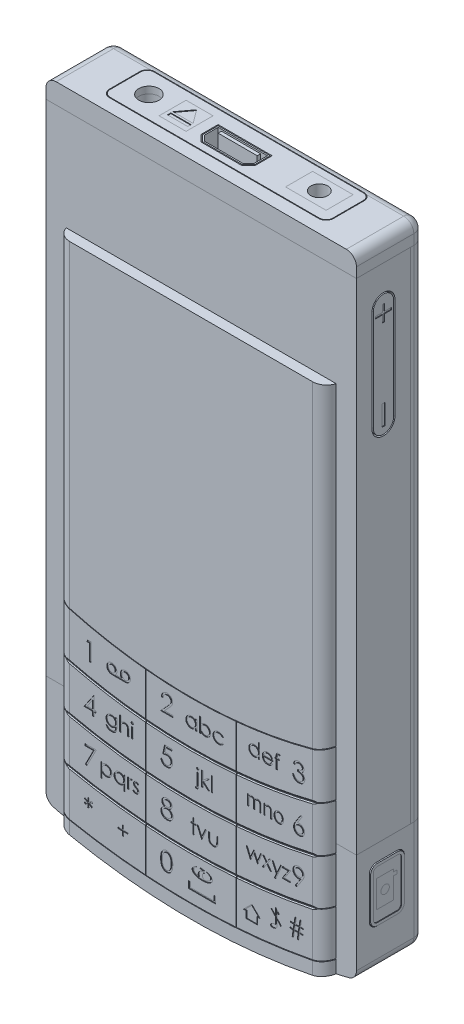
SolidWorks part; units mm, degrees
ref_plane "Front Plane" through (0, 0, 0) normal (0, 0, 1) x (1, 0, 0)
ref_plane "Top Plane" through (0, 0, 0) normal (0, 1, 0) x (1, 0, 0)
ref_plane "Right Plane" through (0, 0, 0) normal (1, 0, 0) x (0, 0, -1)
sketch "Sketch1" plane through (0, 0, 0) normal (0, 0, 1) x (1, 0, 0)
  line L0 (0, -93) -> (46, -93) construction
  line L1 (0, 0) -> (46, 0)
  line L2 (0, 0) -> (0, -93)
  line L3 (23, -96) -> (23, -93) construction
  line L4 (46, 0) -> (46, -93)
  arc A0 (0, -93) -> (46, -93) centre (23, -6.3333) ccw
  point P1 (46, -96)
  point P2 (0, -96)
  dimension "D1" = 46
  dimension "D2" = 93
  dimension "D3" = 3
extrude "Extrude1" add sketch "Sketch1" along normal blind 10
sketch "Sketch2" plane through (0, 0, 10) normal (0, 0, 1) x (1, 0, 0)
  line L0 (0, -3) -> (46, -3)
  line L1 (0, 0) -> (0, -93) construction
  line L2 (46, -93) -> (46, 0) construction
  line L3 (0, -77) -> (46, -77)
  line L4 (46, 0) -> (0, 0) construction
  arc A0 (0, -93) -> (46, -93) centre (23, -6.3333) ccw construction
  point P14 (23, -96)
  dimension "D1" = 19
  dimension "D2" = 3
split "Split1" trim tools "Sketch2" bodies to split 101 resulting bodies 102 103 104
sketch "Sketch3" plane through (0, 0, 10) normal (0, 0, 1) x (1, 0, 0)
  line L11 (0, -3) -> (0, -77) construction
  line L12 (46, -93) -> (46, -77) construction
  line L13 (3, -18) -> (3, -64.5)
  line L14 (23, -67.5) -> (23, -64.5) construction
  line L16 (3, -18) -> (43, -18)
  line L17 (0, -3) -> (46, -3) construction
  line L21 (43, -64.5) -> (43, -18)
  arc A1 (0, -93) -> (46, -93) centre (23, -6.3333) ccw construction
  arc A5 (3, -64.5) -> (43, -64.5) centre (23, 0.6667) ccw
  dimension "D4" = 3
  dimension "D1" = 3
  dimension "D3" = 15
  dimension "D2" = 3
  dimension "D5" = 46.5
extrude "Extrude2" add sketch "Sketch3" along normal blind 1.5
sketch "Sketch8" plane through (0, 0, 10) normal (0, 0, 1) x (1, 0, 0)
  line L0 (3, -64.6046) -> (3, -71.3754)
  line L1 (43, -64.6046) -> (43, -71.3754)
  line L2 (16.25, -67.2655) -> (16.25, -73.7947)
  line L3 (29.75, -67.2655) -> (29.75, -73.7947)
  line L4 (16.35, -67.2753) -> (16.35, -73.8037)
  line L5 (29.65, -67.2753) -> (29.65, -73.8037)
  line L6 (3, -85.0989) -> (3, -91.7609)
  line L7 (3, -64.5) -> (3, -93.7411) construction
  line L8 (3, -78.3069) -> (3, -84.9962)
  line L9 (3, -71.4791) -> (3, -78.2037)
  line L10 (43, -64.5) -> (43, -18) construction
  line L11 (43, -64.5) -> (43, -93.7411) construction
  line L12 (43, -71.4791) -> (43, -78.2037)
  line L13 (43, -78.3069) -> (43, -84.9962)
  line L14 (43, -85.0989) -> (43, -91.7609)
  line L15 (16.25, -87.1409) -> (16.25, -93.6588)
  line L16 (16.25, -64.5) -> (16.25, -93.7411) construction
  line L17 (16.35, -64.5) -> (16.35, -93.7411) construction
  line L18 (29.75, -64.5) -> (29.75, -93.7411) construction
  line L19 (29.65, -64.5) -> (29.65, -93.7411) construction
  line L20 (16.35, -87.1486) -> (16.35, -93.6659)
  line L21 (29.65, -87.1486) -> (29.65, -93.6659)
  line L22 (29.75, -87.1409) -> (29.75, -93.6588)
  line L23 (29.65, -80.5281) -> (29.65, -87.0483)
  line L24 (29.75, -80.5199) -> (29.75, -87.0406)
  line L25 (16.25, -80.5199) -> (16.25, -87.0406)
  line L26 (16.35, -80.5281) -> (16.35, -87.0483)
  line L27 (16.25, -73.8951) -> (16.25, -80.4195)
  line L28 (16.35, -73.9041) -> (16.35, -80.4278)
  line L29 (29.75, -73.8951) -> (29.75, -80.4195)
  line L30 (29.65, -73.9041) -> (29.65, -80.4278)
  arc A0 (3, -78.3069) -> (16.25, -80.5199) centre (23, 0.6667) ccw
  arc A1 (3, -71.3754) -> (16.25, -73.7947) centre (23, 0.6667) ccw
  arc A2 (2.9707, -64.5956) -> (43.0293, -64.5956) centre (23, 0.6667) ccw
  arc A3 (3, -64.6046) -> (16.25, -67.2655) centre (23, 0.6667) ccw
  arc A4 (0, -93) -> (46, -93) centre (23, -6.3333) ccw construction
  arc A5 (3, -71.4791) -> (16.25, -73.8951) centre (23, 0.6667) ccw
  arc A6 (3, -78.2037) -> (16.25, -80.4195) centre (23, 0.6667) ccw
  arc A7 (3, -84.9962) -> (16.25, -87.0406) centre (23, 0.6667) ccw
  arc A8 (3, -85.0989) -> (16.25, -87.1409) centre (23, 0.6667) ccw
  arc A9 (3, -91.7609) -> (16.25, -93.6588) centre (23, 0.6667) ccw
  arc A10 (16.35, -93.6659) -> (29.65, -93.6659) centre (23, 0.6667) ccw
  arc A11 (2.9707, -64.5956) -> (43.0293, -64.5956) centre (23, 0.6667) ccw construction
  arc A12 (1.0636, -70.8095) -> (44.9364, -70.8095) centre (23, 0.6667) ccw construction
  arc A13 (1.0342, -70.9051) -> (44.9658, -70.9051) centre (23, 0.6667) ccw construction
  arc A14 (-0.8729, -77.1191) -> (46.8729, -77.1191) centre (23, 0.6667) ccw construction
  arc A15 (-0.9022, -77.2147) -> (46.9022, -77.2147) centre (23, 0.6667) ccw construction
  arc A16 (-2.8093, -83.4286) -> (48.8093, -83.4286) centre (23, 0.6667) ccw construction
  arc A17 (-2.8386, -83.5242) -> (48.8386, -83.5242) centre (23, 0.6667) ccw construction
  arc A18 (-4.7457, -89.7381) -> (50.7457, -89.7381) centre (23, 0.6667) ccw construction
  arc A19 (29.75, -93.6588) -> (43, -91.7609) centre (23, 0.6667) ccw
  arc A20 (16.35, -87.0483) -> (29.65, -87.0483) centre (23, 0.6667) ccw
  arc A21 (16.35, -87.1486) -> (29.65, -87.1486) centre (23, 0.6667) ccw
  arc A22 (29.75, -87.0406) -> (43, -84.9962) centre (23, 0.6667) ccw
  arc A23 (29.75, -87.1409) -> (43, -85.0989) centre (23, 0.6667) ccw
  arc A24 (29.75, -80.4195) -> (43, -78.2037) centre (23, 0.6667) ccw
  arc A25 (29.75, -80.5199) -> (43, -78.3069) centre (23, 0.6667) ccw
  arc A26 (16.35, -80.4278) -> (29.65, -80.4278) centre (23, 0.6667) ccw
  arc A27 (16.35, -80.5281) -> (29.65, -80.5281) centre (23, 0.6667) ccw
  arc A28 (16.35, -73.8037) -> (29.65, -73.8037) centre (23, 0.6667) ccw
  arc A29 (16.35, -73.9041) -> (29.65, -73.9041) centre (23, 0.6667) ccw
  arc A30 (29.75, -73.7947) -> (43, -71.3754) centre (23, 0.6667) ccw
  arc A31 (29.75, -73.8951) -> (43, -71.4791) centre (23, 0.6667) ccw
  arc A32 (29.75, -67.2655) -> (43, -64.6046) centre (23, 0.6667) ccw
  arc A33 (16.35, -67.2753) -> (29.65, -67.2753) centre (23, 0.6667) ccw
  dimension "D9" = 13.25
  dimension "D1" = 0.1
  dimension "D2" = 6.5
  dimension "D3" = 0.1
  dimension "D4" = 6.5
  dimension "D5" = 0.1
  dimension "D6" = 6.5
  dimension "D7" = 0.1
  dimension "D8" = 6.5
  dimension "D10" = 13.25
  dimension "D11" = 0.1
  dimension "D12" = 0.1
extrude "Extrude3" add sketch "Sketch8" along normal blind 1.5 separate body
sketch "Sketch9" plane through (0, 0, 10) normal (0, 0, 1) x (1, 0, 0)
  line L0 (3, -91.8632) -> (3, -93.7411)
  line L1 (43, -91.8632) -> (43, -93.7411)
  line L2 (43, -91.7609) -> (43, -85.0989) construction
  line L3 (3, -85.0989) -> (3, -91.7609) construction
  arc A0 (0, -93) -> (46, -93) centre (23, -6.3333) ccw construction
  arc A1 (3, -93.7411) -> (43, -93.7411) centre (23, -6.3333) ccw
  arc A4 (2.9789, -91.8586) -> (16.2429, -93.7585) centre (23, 0.6667) ccw
  arc A5 (3, -91.8632) -> (43, -91.8632) centre (23, 0.6667) ccw
  dimension "D1" = 0.1
extrude "Extrude4" add sketch "Sketch9" along normal blind 1.5
sketch "Sketch11" plane through (0, -18, 0) normal (0, 1, 0) x (1, 0, 0)
  line L0 (3, -10) -> (3, -11.5)
  line L1 (3, -11.5) -> (3, -10) construction
  line L2 (3, -11.5) -> (5, -11.5)
  line L3 (43, -11.5) -> (3, -11.5) construction
  line L4 (41, -11.5) -> (43, -11.5)
  line L5 (43, -11.5) -> (43, -10)
  line L6 (43, -11.5) -> (43, -10) construction
  arc A0 (3, -10) -> (5, -11.5) centre (5.0125, -9.4) ccw
  arc A1 (41, -11.5) -> (43, -10) centre (40.9875, -9.4) ccw
  dimension "D3" = 2.1
  dimension "D6" = 2.1
  dimension "D1" = 1.5
  dimension "D2" = 2
  dimension "D4" = 2
  dimension "D5" = 1.5
extrude "Extrude5" cut sketch "Sketch11" against normal up to surface (75.7411 mm away)
chamfer "Chamfer1" distance 0.1 angle 60 1 edges at (10.5888, -73.0627, 11.5)
chamfer "Chamfer2" distance 0.1 angle 60
chamfer "Chamfer3" distance 0.1 angle 60
chamfer "Chamfer4" distance 0.1 angle 60
chamfer "Chamfer5" distance 0.1 angle 60
chamfer "Chamfer6" distance 0.1 angle 60
chamfer "Chamfer7" distance 0.1 angle 60
chamfer "Chamfer8" distance 0.1 angle 60
chamfer "Chamfer9" distance 0.1 angle 60
chamfer "Chamfer10" distance 0.1 angle 60
chamfer "Chamfer11" distance 0.1 angle 60
chamfer "Chamfer12" distance 0.1 angle 60
sketch "Sketch12" plane through (0, 0, 11.5) normal (0, 0, 1) x (1, 0, 0)
  line L0 (16.25, -70.4431) -> (5, -70.4431) construction
  line L1 (11.25, -70.4431) -> (13.25, -70.4431)
  line L2 (29.75, -87.1409) -> (29.75, -93.6588) construction
  line L3 (12.691, -70.1931) -> (11.809, -70.1931)
  line L4 (26.65, -92.2026) -> (26.65, -91.2026)
  line L5 (16.25, -73.6208) -> (16.25, -67.2655) construction
  line L6 (5, -71.7225) -> (5, -65.1842) construction
  line L7 (29.75, -70.4431) -> (41, -70.4431) construction
  line L8 (29.75, -67.2655) -> (29.75, -73.6208) construction
  line L9 (41, -71.7225) -> (41, -65.1842) construction
  line L10 (29.65, -71.4526) -> (16.35, -71.4526) construction
  line L11 (29.65, -73.6298) -> (29.65, -67.2753) construction
  line L12 (16.35, -67.2753) -> (16.35, -73.6298) construction
  line L13 (16.25, -77.1931) -> (5, -77.1931) construction
  line L14 (29.65, -78.2026) -> (16.35, -78.2026) construction
  line L15 (29.75, -77.1931) -> (41, -77.1931) construction
  line L16 (16.25, -83.9431) -> (5, -83.9431) construction
  line L17 (29.65, -84.9526) -> (16.35, -84.9526) construction
  line L18 (29.75, -83.9431) -> (41, -83.9431) construction
  line L19 (29.75, -90.6931) -> (41, -90.6931) construction
  line L20 (29.65, -91.7026) -> (16.35, -91.7026) construction
  line L21 (16.25, -90.6931) -> (5, -90.6931) construction
  line L22 (16.25, -69.6931) -> (5, -69.6931) construction
  line L23 (12.25, -69.6931) -> (12.25, -70.4431) construction
  line L24 (11.25, -69.6931) -> (11.25, -70.4431) construction
  line L25 (13.25, -69.6931) -> (13.25, -70.4431) construction
  line L26 (26.65, -91.2026) -> (26.4, -91.2026)
  line L27 (26.4, -91.2026) -> (26.4, -91.9526)
  line L28 (26.4, -91.9526) -> (22.9, -91.9526)
  line L29 (22.9, -91.9526) -> (22.9, -91.2026)
  line L30 (22.9, -91.2026) -> (22.65, -91.2026)
  line L31 (22.65, -91.2026) -> (22.65, -92.2026)
  line L32 (22.65, -92.2026) -> (26.65, -92.2026)
  line L33 (31.25, -91.6931) -> (31.25, -90.6931)
  line L34 (29.65, -93.6659) -> (29.65, -87.3223) construction
  line L35 (31.25, -90.6931) -> (31, -90.6931)
  line L36 (31, -90.6931) -> (32, -89.6931)
  line L37 (32, -89.6931) -> (33, -90.6931)
  line L38 (33, -90.6931) -> (32.75, -90.6931)
  line L39 (32.75, -90.6931) -> (32.75, -91.6931)
  line L40 (32.75, -91.6931) -> (31.25, -91.6931)
  line L41 (32, -89.5517) -> (33.2414, -90.7931)
  line L42 (33.2414, -90.7931) -> (32.85, -90.7931)
  line L43 (32.85, -90.7931) -> (32.85, -91.7931)
  line L44 (32.85, -91.7931) -> (31.15, -91.7931)
  line L45 (31.15, -91.7931) -> (31.15, -90.7931)
  line L46 (31.15, -90.7931) -> (30.7586, -90.7931)
  line L47 (30.7586, -90.7931) -> (32, -89.5517)
  line L48 (35.7192, -90.5452) -> (35.7192, -89.6275)
  line L49 (35.7192, -88.6836) -> (35.9433, -88.9263)
  line L50 (35.9433, -88.9263) -> (36.0902, -88.7907)
  line L51 (36.0902, -88.7907) -> (35.5192, -88.1721)
  line L52 (35.5192, -88.1721) -> (35.5192, -89.2339)
  line L53 (34.9304, -88.5961) -> (35.5192, -89.2339)
  line L54 (36.3765, -90.1626) -> (36.2883, -90.244)
  line L55 (36.2883, -90.244) -> (35.7192, -89.6275)
  line L56 (34.8423, -88.6774) -> (34.9304, -88.5961)
  line L57 (29.75, -87.3147) -> (29.75, -93.6588) construction
  line L58 (35.7192, -89.4505) -> (36.3765, -90.1626)
  line L59 (35.5192, -89.4108) -> (34.8423, -88.6774)
  line L60 (35.5192, -89.4108) -> (35.5192, -90.4036)
  line L61 (35.7192, -89.4505) -> (35.7192, -88.6836)
  arc A0 (11.809, -70.1931) -> (11.25, -70.4431) centre (11.25, -69.6931) ccw
  arc A1 (13.25, -70.4431) -> (12.691, -70.1931) centre (13.25, -69.6931) ccw
  circle A2 centre (11.25, -69.6931) radius 0.5
  circle A3 centre (13.25, -69.6931) radius 0.5
  circle A5 centre (11.25, -69.6931) radius 0.75 construction
  circle A6 centre (13.25, -69.6931) radius 0.75 construction
  ellipse E0 centre (35.25, -90.6931) end of major axis (35.7192, -90.5452) minor radius 0.2729 (35.5192, -90.4036) -> (35.7192, -90.5452) ccw
  text T0 "  1" font "Century Gothic" height in points 10
  text T1 "  2" font "Century Gothic" height in points 10
  text T2 "       abc" font "Century Gothic" height in points 8
  text T3 "  3 " font "Century Gothic" height in points 10
  text T4 "  def" font "Century Gothic" height in points 8
  text T5 "  4" font "Century Gothic" height in points 10
  text T6 "ghi  " font "Century Gothic" height in points 8
  text T7 "  5" font "Century Gothic" height in points 10
  text T8 "jkl    " font "Century Gothic" height in points 8
  text T9 "6 " font "Century Gothic" height in points 10
  text T10 "  mno" font "Century Gothic" height in points 8
  text T11 "  7" font "Century Gothic" height in points 10
  text T12 "pqrs " font "Century Gothic" height in points 8
  text T13 " 8  " font "Century Gothic" height in points 10
  text T14 "tvu   " font "Century Gothic" height in points 8
  text T15 "  9 " font "Century Gothic" height in points 10
  text T16 "wxyz    " font "Century Gothic" height in points 8
  text T17 "  *" font "Century Gothic" height in points 10
  text T18 "+   " font "Century Gothic" height in points 8
  text T19 "  0" font "Century Gothic" height in points 10
  text T20 "# " font "Century Gothic" height in points 10
  point P18 (16.35, -70.4526)
  point P48 (16.25, -70.1931)
  point P49 (5, -70.1931)
  point P54 (12.4672, -69.4738)
  point P59 (14.4672, -69.4738)
  point P78 (29.65, -92.2026)
  point P79 (16.35, -92.2026)
  dimension "D1" = 1
  dimension "D12" = 4
  dimension "D13" = 0.25
  dimension "D16" = 0.25
  dimension "D17" = 0.25
  dimension "D18" = 1
  dimension "D19" = 1
  dimension "D20" = 4
  dimension "D21" = 0.5
  dimension "D15" = 0.25
  dimension "D22" = 3
  dimension "D23" = 1.5
  dimension "D24" = 0.25
  dimension "D25" = 0.25
  dimension "D26" = 0.75
  dimension "D27" = 1
  dimension "D28" = 1
  dimension "D29" = 1
  dimension "D30" = 1.5
  dimension "D32" = 0.12
  dimension "D33" = 0.2
  dimension "D34" = 0.2
  dimension "D35" = 5.5
  dimension "D2" = 6.75
  dimension "D3" = 6.75
  dimension "D4" = 6.75
  dimension "D5" = 6.75
  dimension "D6" = 6.75
  dimension "D7" = 6.75
  dimension "D8" = 6.75
  dimension "D9" = 0.75
  dimension "D10" = 1
  dimension "D11" = 1
  dimension "D14" = 0.25
  dimension "D31" = 0.1
extrude "Extrude6" cut sketch "Sketch12" against normal blind 0.1
sketch "Sketch14" plane through (0, 0, 11.5) normal (0, 0, 1) x (1, 0, 0)
  line L16 (24.05, -88.7823) -> (24.05, -88.7652)
  line L18 (25.25, -88.7823) -> (25.25, -88.7652)
  line L21 (24.05, -88.7652) -> (25.25, -88.7652) construction
  arc A1 (24.15, -89.9483) -> (24.05, -89.7026) centre (24.4273, -89.6923) cw
  arc A2 (24.05, -89.7026) -> (25.0478, -89.1026) centre (24.7183, -89.6843) cw
  arc A3 (25.0478, -89.1026) -> (25.05, -89.9684) centre (25.0844, -89.5354) ccw
  ellipse E0 centre (24.65, -89.4526) end of major axis (23.15, -89.4526) minor radius 0.75 (24.05, -88.7652) -> (25.25, -88.7652) ccw
  ellipse E1 centre (24.65, -89.3526) end of major axis (23.4, -89.3526) minor radius 0.65 (24.05, -88.7823) -> (24.15, -89.9483) ccw
  ellipse E2 centre (24.65, -88.7652) end of major axis (24.35, -88.7652) minor radius 0.1
  ellipse E3 centre (24.65, -89.3526) end of major axis (23.4, -89.3526) minor radius 0.65 (25.05, -89.9684) -> (25.25, -88.7823) ccw
  point P33 (25.25, -91.9526)
  point P35 (25.25, -87.5578)
  point P41 (24.05, -91.9526)
  point P42 (24.05, -87.5578)
  dimension "D12" = 0.1
  dimension "D13" = 0.3
extrude "Extrude7" cut sketch "Sketch14" against normal blind 0.1
sketch "Sketch15" plane through (0, 0, 0) normal (-1, 0, 0) x (0, 0, 1)
  line L0 (2, -3) -> (2, -77)
  line L1 (10, -3) -> (0, -3) construction
  line L2 (10, -77) -> (0, -77) construction
  line L3 (0, -3) -> (0, -77) construction
  dimension "D1" = 2
split "Split2" trim tools "Sketch15" bodies to split 137 resulting bodies 154 155
sketch "Sketch16" plane through (46, 0, 0) normal (1, 0, 0) x (0, 0, -1)
  line L0 (-6, -8.5) -> (-6, -23.5) construction
  line L1 (-4.5, -8.5) -> (-4.5, -23.5)
  line L2 (-7.5, -8.5) -> (-7.5, -23.5)
  line L3 (-2, -3) -> (-2, -77) construction
  line L5 (-2, -3) -> (-10, -3) construction
  arc A0 (-4.5, -8.5) -> (-7.5, -8.5) centre (-6, -8.5) ccw
  arc A1 (-7.5, -23.5) -> (-4.5, -23.5) centre (-6, -23.5) ccw
  point P2 (-6, -16)
  point P9 (-6, -3)
  dimension "D1" = 3
  dimension "D2" = 2.5
  dimension "D3" = 15
  dimension "D4" = 5.5
extrude "Extrude8" cut sketch "Sketch16" against normal blind 1
chamfer "Chamfer13" distance 0.2 angle 60 4 edges at (46, -16, 4.5) (46, -7, 6) (46, -25, 6) (46, -16, 7.5)
sketch "Sketch18" plane through (45, 0, 0) normal (1, 0, 0) x (0, 0, -1)
  line L2 (-7.5, -8.5) -> (-7.5, -23.5)
  line L3 (-4.5, -23.5) -> (-4.5, -8.5)
  line L4 (-7.5, -8.5) -> (-7.5, -23.5)
  line L5 (-4.5, -23.5) -> (-4.5, -8.5)
  arc A2 (-4.5, -8.5) -> (-7.5, -8.5) centre (-6, -8.5) ccw
  arc A3 (-7.5, -23.5) -> (-4.5, -23.5) centre (-6, -23.5) ccw
  arc A4 (-4.5, -8.5) -> (-7.5, -8.5) centre (-6, -8.5) ccw
  arc A5 (-7.5, -23.5) -> (-4.5, -23.5) centre (-6, -23.5) ccw
  dimension "D1" = 0
extrude "Extrude9" add sketch "Sketch18" along normal blind 1 separate body
sketch "Sketch19" plane through (46, 0, 0) normal (1, 0, 0) x (0, 0, -1)
  line L3 (-4.5, -23.5) -> (-4.5, -8.5) construction
  line L4 (-6.25, -21) -> (-5.75, -21)
  line L5 (-6.25, -21) -> (-6.25, -24)
  line L6 (-6.25, -24) -> (-5.75, -24)
  line L7 (-5.75, -21) -> (-5.75, -24)
  arc A3 (-7.5, -23.5) -> (-4.5, -23.5) centre (-6, -23.5) ccw construction
  text T0 "+"
  point P18 (-6, -25)
  dimension "D1" = 0.5
  dimension "D2" = 3
  dimension "D3" = 1
  dimension "D4" = 1.25
extrude "Extrude10" cut sketch "Sketch19" against normal blind 0.1
sketch "Sketch20" plane through (46, 0, 0) normal (1, 0, 0) x (0, 0, -1)
  line L0 (-2, -77) -> (-10, -77) construction
  line L1 (-7, -79.5) -> (-4, -79.5)
  line L2 (-8, -80.5) -> (-8, -86.5)
  line L3 (-7, -87.5) -> (-4, -87.5)
  line L4 (-3, -80.5) -> (-3, -86.5)
  line L5 (-10, -84.9962) -> (-10, -78.3069) construction
  arc A0 (-7, -79.5) -> (-8, -80.5) centre (-7, -80.5) ccw
  arc A1 (-4, -79.5) -> (-3, -80.5) centre (-4, -80.5) cw
  arc A2 (-4, -87.5) -> (-3, -86.5) centre (-4, -86.5) ccw
  arc A3 (-8, -86.5) -> (-7, -87.5) centre (-7, -86.5) ccw
  point P10 (-8, -79.5)
  point P15 (-3, -87.5)
  point P18 (-8, -87.5)
  dimension "D5" = 1
  dimension "D1" = 5
  dimension "D2" = 2.5
  dimension "D3" = 8
  dimension "D4" = 2
extrude "Extrude11" cut sketch "Sketch20" against normal blind 1
sketch "Sketch21" plane through (45, 0, 0) normal (1, 0, 0) x (0, 0, -1)
  line L0 (-4, -79.9) -> (-7, -79.9)
  line L1 (-7.6, -80.5) -> (-7.6, -86.5)
  line L2 (-7, -87.1) -> (-4, -87.1)
  line L3 (-3.4, -86.5) -> (-3.4, -80.5)
  line L4 (-8, -80.5) -> (-8, -86.5)
  line L5 (-7, -87.5) -> (-4, -87.5)
  line L6 (-3, -86.5) -> (-3, -80.5)
  line L7 (-4, -79.5) -> (-7, -79.5)
  line L8 (-8, -80.5) -> (-8, -86.5)
  line L9 (-7, -87.5) -> (-4, -87.5)
  line L10 (-3, -86.5) -> (-3, -80.5)
  line L11 (-4, -79.5) -> (-7, -79.5)
  arc A0 (-7, -79.9) -> (-7.6, -80.5) centre (-7, -80.5) ccw
  arc A1 (-7.6, -86.5) -> (-7, -87.1) centre (-7, -86.5) ccw
  arc A2 (-4, -87.1) -> (-3.4, -86.5) centre (-4, -86.5) ccw
  arc A3 (-3.4, -80.5) -> (-4, -79.9) centre (-4, -80.5) ccw
  arc A4 (-7, -79.5) -> (-8, -80.5) centre (-7, -80.5) ccw
  arc A5 (-8, -86.5) -> (-7, -87.5) centre (-7, -86.5) ccw
  arc A6 (-4, -87.5) -> (-3, -86.5) centre (-4, -86.5) ccw
  arc A7 (-3, -80.5) -> (-4, -79.5) centre (-4, -80.5) ccw
  arc A8 (-7, -79.5) -> (-8, -80.5) centre (-7, -80.5) ccw
  arc A9 (-8, -86.5) -> (-7, -87.5) centre (-7, -86.5) ccw
  arc A10 (-4, -87.5) -> (-3, -86.5) centre (-4, -86.5) ccw
  arc A11 (-3, -80.5) -> (-4, -79.5) centre (-4, -80.5) ccw
  dimension "D1" = 0
  dimension "D2" = 0.4
extrude "Extrude12" add sketch "Sketch21" along normal blind 1.1 separate body
chamfer "Chamfer14" distance 0.1 angle 60
sketch "Sketch22" plane through (45, 0, 0) normal (1, 0, 0) x (0, 0, -1)
  line L0 (-3.4, -86.5) -> (-3.4, -80.5) construction
  line L1 (-3.4, -86.5) -> (-3.4, -80.5)
  line L2 (-7, -87.1) -> (-4, -87.1) construction
  line L3 (-7.6, -80.5) -> (-7.6, -86.5) construction
  line L4 (-4, -79.9) -> (-7, -79.9) construction
  line L5 (-7, -87.1) -> (-4, -87.1)
  line L6 (-7.6, -80.5) -> (-7.6, -86.5)
  line L7 (-4, -79.9) -> (-7, -79.9)
  arc A0 (-4, -87.1) -> (-3.4, -86.5) centre (-4, -86.5) ccw construction
  arc A1 (-7.6, -86.5) -> (-7, -87.1) centre (-7, -86.5) ccw construction
  arc A2 (-7, -79.9) -> (-7.6, -80.5) centre (-7, -80.5) ccw construction
  arc A3 (-3.4, -80.5) -> (-4, -79.9) centre (-4, -80.5) ccw construction
  arc A4 (-4, -87.1) -> (-3.4, -86.5) centre (-4, -86.5) ccw
  arc A5 (-7.6, -86.5) -> (-7, -87.1) centre (-7, -86.5) ccw
  arc A6 (-7, -79.9) -> (-7.6, -80.5) centre (-7, -80.5) ccw
  arc A7 (-3.4, -80.5) -> (-4, -79.9) centre (-4, -80.5) ccw
extrude "Extrude13" add sketch "Sketch22" along normal blind 1 separate body
sketch "Sketch23" plane through (46, 0, 0) normal (1, 0, 0) x (0, 0, -1)
  line L0 (-7.6, -80.5) -> (-7.6, -86.5) construction
  line L1 (-7, -81.5) -> (-4.5, -81.5)
  line L2 (-7, -81.5) -> (-7, -85.5)
  line L3 (-7, -85.5) -> (-4.5, -85.5)
  line L4 (-4.5, -81.5) -> (-4.5, -81.9)
  line L6 (-4, -79.9) -> (-7, -79.9) construction
  line L7 (-7, -87.1) -> (-4, -87.1) construction
  line L8 (-4.5, -82.4) -> (-4.5, -85.5)
  line L9 (-4.5, -81.9) -> (-4, -81.9)
  line L11 (-4.5, -82.4) -> (-4, -82.4)
  line L12 (-4, -81.9) -> (-4, -82.4)
  circle A0 centre (-5.75, -83.5) radius 0.625
  dimension "D6" = 1.25
  dimension "D7" = 1.25
  dimension "D8" = 2
  dimension "D1" = 2.5
  dimension "D2" = 0.6
  dimension "D3" = 4
  dimension "D4" = 1.6
  dimension "D5" = 1.6
  dimension "D9" = 0.5
  dimension "D10" = 0.5
  dimension "D11" = 0.4
extrude "Extrude14" cut sketch "Sketch23" against normal blind 0.1
sketch "Sketch24" plane through (45.9, 0, 0) normal (1, 0, 0) x (0, 0, -1)
  line L8 (-7, -81.5) -> (-7, -85.5)
  line L9 (-7, -85.5) -> (-4.5, -85.5)
  line L10 (-4.5, -85.5) -> (-4.5, -82.4)
  line L11 (-4.5, -82.4) -> (-4, -82.4)
  line L12 (-4, -82.4) -> (-4, -81.9)
  line L13 (-4, -81.9) -> (-4.5, -81.9)
  line L14 (-4.5, -81.9) -> (-4.5, -81.5)
  line L15 (-4.5, -81.5) -> (-7, -81.5)
  line L16 (-7, -81.5) -> (-7, -85.5)
  line L17 (-7, -85.5) -> (-4.5, -85.5)
  line L18 (-4.5, -85.5) -> (-4.5, -82.4)
  line L19 (-4.5, -82.4) -> (-4, -82.4)
  line L20 (-4, -82.4) -> (-4, -81.9)
  line L21 (-4, -81.9) -> (-4.5, -81.9)
  line L22 (-4.5, -81.9) -> (-4.5, -81.5)
  line L23 (-4.5, -81.5) -> (-7, -81.5)
  circle A0 centre (-5.75, -83.5) radius 0.625 construction
  circle A1 centre (-5.75, -83.5) radius 0.625
  dimension "D1" = 0
extrude "Extrude15" add sketch "Sketch24" along normal blind 0.1 separate body
sketch "Sketch25" plane through (0, 0, 0) normal (0, 1, 0) x (1, 0, 0)
  line L0 (46, 0) -> (0, 0) construction
  line L1 (7.5, -1.5) -> (38.5, -1.5)
  line L2 (6.5, -2.5) -> (6.5, -7)
  line L3 (7.5, -8) -> (38.5, -8)
  line L4 (39.5, -2.5) -> (39.5, -7)
  line L6 (0, -10) -> (0, 0) construction
  arc A0 (7.5, -1.5) -> (6.5, -2.5) centre (7.5, -2.5) ccw
  arc A1 (6.5, -7) -> (7.5, -8) centre (7.5, -7) ccw
  arc A2 (38.5, -8) -> (39.5, -7) centre (38.5, -7) ccw
  arc A3 (38.5, -1.5) -> (39.5, -2.5) centre (38.5, -2.5) cw
  point P10 (6.5, -1.5)
  point P13 (6.5, -8)
  point P16 (39.5, -8)
  dimension "D5" = 1
  dimension "D1" = 6.5
  dimension "D2" = 1.5
  dimension "D3" = 33
  dimension "D4" = 6.5
extrude "Extrude16" cut sketch "Sketch25" against normal blind 1
chamfer "Chamfer15" distance 0.1 angle 60 8 edges at (39.5, 0, 4.75) (39.2071, 0, 1.7929) (39.2071, 0, 7.7071) (23, 0, 1.5) (23, 0, 8) (6.7929, 0, 1.7929) (6.7929, 0, 7.7071) (6.5, 0, 4.75)
sketch "Sketch26" plane through (0, -1, 0) normal (0, 1, 0) x (1, 0, 0)
  line L4 (6.5, -2.5) -> (6.5, -7)
  line L5 (7.5, -8) -> (38.5, -8)
  line L6 (39.5, -7) -> (39.5, -2.5)
  line L7 (38.5, -1.5) -> (7.5, -1.5)
  line L8 (6.5, -2.5) -> (6.5, -7)
  line L9 (7.5, -8) -> (38.5, -8)
  line L10 (39.5, -7) -> (39.5, -2.5)
  line L11 (38.5, -1.5) -> (7.5, -1.5)
  arc A4 (7.5, -1.5) -> (6.5, -2.5) centre (7.5, -2.5) ccw
  arc A5 (6.5, -7) -> (7.5, -8) centre (7.5, -7) ccw
  arc A6 (38.5, -8) -> (39.5, -7) centre (38.5, -7) ccw
  arc A7 (39.5, -2.5) -> (38.5, -1.5) centre (38.5, -2.5) ccw
  arc A8 (7.5, -1.5) -> (6.5, -2.5) centre (7.5, -2.5) ccw
  arc A9 (6.5, -7) -> (7.5, -8) centre (7.5, -7) ccw
  arc A10 (38.5, -8) -> (39.5, -7) centre (38.5, -7) ccw
  arc A11 (39.5, -2.5) -> (38.5, -1.5) centre (38.5, -2.5) ccw
  dimension "D1" = 0
extrude "Extrude17" add sketch "Sketch26" along normal blind 1 separate body
sketch "Sketch27" plane through (0, 0, 0) normal (0, 1, 0) x (1, 0, 0)
  line L0 (6.4, -4.75) -> (39.6, -4.75) construction
  line L1 (6.4, -7) -> (6.4, -2.5) construction
  line L2 (39.6, -2.5) -> (39.6, -7) construction
  line L3 (6.5, -2.5) -> (6.5, -7) construction
  line L4 (38.5, -1.5) -> (7.5, -1.5) construction
  line L5 (32, -2.5) -> (38, -2.5)
  line L6 (32, -2.5) -> (32, -6.5)
  line L7 (32, -6.5) -> (38, -6.5)
  line L8 (38, -2.5) -> (38, -6.5)
  line L9 (39.5, -7) -> (39.5, -2.5) construction
  line L10 (7.5, -8) -> (38.5, -8) construction
  line L11 (19, -3.5) -> (27, -3.5)
  line L12 (19, -3.5) -> (19, -6)
  line L13 (20, -7) -> (26, -7)
  line L14 (27, -3.5) -> (27, -6)
  line L15 (19, -6) -> (20, -7)
  line L16 (26, -7) -> (27, -6)
  line L18 (13.5, -2.75) -> (17.5, -2.75)
  line L19 (13.5, -2.75) -> (13.5, -6.75)
  line L20 (13.5, -6.75) -> (17.5, -6.75)
  line L21 (17.5, -2.75) -> (17.5, -6.75)
  circle A0 centre (10, -4.75) radius 1.5
  point P19 (27, -7)
  point P20 (19, -7)
  dimension "D1" = 3
  dimension "D2" = 3.5
  dimension "D3" = 4
  dimension "D4" = 1
  dimension "D5" = 6
  dimension "D6" = 1.5
  dimension "D7" = 8
  dimension "D8" = 12.5
  dimension "D9" = 3.5
  dimension "D10" = 1
  dimension "D13" = 1
  dimension "D14" = 1
  dimension "D11" = 4
  dimension "D12" = 4
  dimension "D15" = 2
  dimension "D16" = 7
extrude "Extrude18" cut sketch "Sketch27" against normal blind 5
sketch "Sketch28" plane through (0, -5, 0) normal (0, 1, 0) x (1, 0, 0)
  line L4 (13.5, -2.75) -> (13.5, -6.75)
  line L5 (13.5, -6.75) -> (17.5, -6.75)
  line L6 (17.5, -6.75) -> (17.5, -2.75)
  line L7 (17.5, -2.75) -> (13.5, -2.75)
  line L8 (13.5, -2.75) -> (13.5, -6.75)
  line L9 (13.5, -6.75) -> (17.5, -6.75)
  line L10 (17.5, -6.75) -> (17.5, -2.75)
  line L11 (17.5, -2.75) -> (13.5, -2.75)
  line L12 (32, -2.5) -> (32, -6.5)
  line L13 (32, -6.5) -> (38, -6.5)
  line L14 (38, -6.5) -> (38, -2.5)
  line L15 (38, -2.5) -> (32, -2.5)
  line L16 (32, -2.5) -> (32, -6.5)
  line L17 (32, -6.5) -> (38, -6.5)
  line L18 (38, -6.5) -> (38, -2.5)
  line L19 (38, -2.5) -> (32, -2.5)
  circle A0 centre (35, -4.5) radius 1.25
  dimension "D3" = 2.5
  dimension "D4" = 2
  dimension "D5" = 3
  dimension "D1" = 0
  dimension "D2" = 0
extrude "Extrude19" add sketch "Sketch28" along normal blind 5 separate body
sketch "Sketch29" plane through (0, -5, 0) normal (0, 1, 0) x (1, 0, 0)
  line L6 (26.65, -3.85) -> (19.35, -3.85)
  line L7 (19.35, -3.85) -> (19.35, -5.855)
  line L8 (19.35, -5.855) -> (20.145, -6.65)
  line L9 (20.145, -6.65) -> (25.855, -6.65)
  line L10 (25.855, -6.65) -> (26.65, -5.855)
  line L11 (26.65, -5.855) -> (26.65, -3.85)
  line L12 (19.15, -3.65) -> (19.15, -5.9379)
  line L13 (19.15, -5.9379) -> (20.0621, -6.85)
  line L14 (20.0621, -6.85) -> (25.9379, -6.85)
  line L15 (25.9379, -6.85) -> (26.85, -5.9379)
  line L16 (26.85, -5.9379) -> (26.85, -3.65)
  line L17 (26.85, -3.65) -> (19.15, -3.65)
  line L18 (19.15, -3.65) -> (19.15, -5.9379)
  line L19 (19.15, -5.9379) -> (20.0621, -6.85)
  line L20 (20.0621, -6.85) -> (25.9379, -6.85)
  line L21 (25.9379, -6.85) -> (26.85, -5.9379)
  line L22 (26.85, -5.9379) -> (26.85, -3.65)
  line L23 (26.85, -3.65) -> (19.15, -3.65)
  line L25 (20.1, -4.1) -> (25.9, -4.1)
  line L26 (20.1, -4.1) -> (20.1, -4.6)
  line L27 (20.1, -4.6) -> (25.9, -4.6)
  line L28 (25.9, -4.1) -> (25.9, -4.6)
  dimension "D3" = 0.5
  dimension "D4" = 0.25
  dimension "D5" = 0.75
  dimension "D6" = 0.75
  dimension "D1" = 0.15
  dimension "D2" = 0.2
extrude "Extrude20" add sketch "Sketch29" along normal blind 5 separate body contours L28 L25 L26 L27 | L22 L23 L18 L19 L20 L21 L11 L10 L9 L8 L7 L6
sketch "Sketch30" plane through (0, 0, 0) normal (0, 1, 0) x (1, 0, 0)
  line L0 (15.5, -2.75) -> (15.5, -6.75) construction
  line L1 (17.5, -2.75) -> (13.5, -2.75) construction
  line L2 (13.5, -6.75) -> (17.5, -6.75) construction
  line L3 (13.5, -2.75) -> (13.5, -6.75) construction
  line L4 (14, -5.5) -> (17, -5.5)
  line L5 (14, -5.5) -> (14, -6)
  line L6 (14, -6) -> (17, -6)
  line L7 (17, -5.5) -> (17, -6)
  line L8 (17.5, -6.75) -> (17.5, -2.75) construction
  line L9 (13.5, -6.75) -> (17.5, -6.75) construction
  line L10 (17, -5.2) -> (14, -5.2)
  line L11 (14, -5.2) -> (15.5, -3.2)
  line L12 (15.5, -3.2) -> (17, -5.2)
  dimension "D1" = 0.5
  dimension "D2" = 0.5
  dimension "D3" = 0.5
  dimension "D4" = 0.75
  dimension "D5" = 2
  dimension "D6" = 0.3
extrude "Extrude21" cut sketch "Sketch30" against normal blind 0.1
sketch "Sketch31" plane through (0, 0, 0) normal (0, 0, -1) x (-1, 0, 0)
  line L0 (-46, -77) -> (-46, -3) construction
  line L1 (-38.5, -13) -> (-30.5, -13)
  line L2 (-41, -15.5) -> (-41, -23.5)
  line L3 (-38.5, -26) -> (-30.5, -26)
  line L4 (-28, -15.5) -> (-28, -23.5)
  line L5 (0, -3) -> (-46, -3) construction
  line L6 (-38.5, -15) -> (-30.5, -15)
  line L7 (-30, -15.5) -> (-30, -23.5)
  line L8 (-38.5, -24) -> (-30.5, -24)
  line L9 (-39, -15.5) -> (-39, -23.5)
  arc A0 (-38.5, -13) -> (-41, -15.5) centre (-38.5, -15.5) ccw
  arc A1 (-41, -23.5) -> (-38.5, -26) centre (-38.5, -23.5) ccw
  arc A2 (-30.5, -26) -> (-28, -23.5) centre (-30.5, -23.5) ccw
  arc A3 (-30.5, -13) -> (-28, -15.5) centre (-30.5, -15.5) cw
  arc A4 (-30.5, -15) -> (-30, -15.5) centre (-30.5, -15.5) cw
  arc A5 (-30.5, -24) -> (-30, -23.5) centre (-30.5, -23.5) ccw
  arc A6 (-39, -23.5) -> (-38.5, -24) centre (-38.5, -23.5) ccw
  arc A7 (-38.5, -15) -> (-39, -15.5) centre (-38.5, -15.5) ccw
  circle A8 centre (-34.5, -19.5) radius 2.5
  point P10 (-41, -13)
  point P13 (-41, -26)
  point P18 (-28, -13)
  dimension "D5" = 2.5
  dimension "D7" = 5
  dimension "D8" = 4.5
  dimension "D9" = 4.5
  dimension "D1" = 5
  dimension "D2" = 13
  dimension "D3" = 10
  dimension "D4" = 13
  dimension "D6" = 2
extrude "Extrude22" cut sketch "Sketch31" against normal blind 5 contours A8 | A3 L1 A0 L2 A1 L3 A2 L4 A7 L6 A4 L7 A5 L8 A6 L9
sketch "Sketch32" plane through (0, 0, 5) normal (0, 0, -1) x (-1, 0, 0)
  line L1 (-30.5, -15) -> (-38.5, -15)
  line L2 (-39, -15.5) -> (-39, -23.5)
  line L3 (-38.5, -24) -> (-30.5, -24)
  line L4 (-30.5, -13) -> (-38.5, -13)
  line L5 (-41, -15.5) -> (-41, -23.5)
  line L6 (-38.5, -26) -> (-30.5, -26)
  line L7 (-28, -23.5) -> (-28, -15.5)
  line L8 (-30.5, -13) -> (-38.5, -13)
  line L9 (-41, -15.5) -> (-41, -23.5)
  line L10 (-38.5, -26) -> (-30.5, -26)
  line L11 (-28, -23.5) -> (-28, -15.5)
  line L12 (-30, -23.5) -> (-30, -15.5)
  arc A0 (-38.5, -15) -> (-39, -15.5) centre (-38.5, -15.5) ccw
  arc A1 (-39, -23.5) -> (-38.5, -24) centre (-38.5, -23.5) ccw
  arc A2 (-30.5, -24) -> (-30, -23.5) centre (-30.5, -23.5) ccw
  arc A3 (-30, -15.5) -> (-30.5, -15) centre (-30.5, -15.5) ccw
  arc A4 (-28, -15.5) -> (-30.5, -13) centre (-30.5, -15.5) ccw
  arc A5 (-38.5, -13) -> (-41, -15.5) centre (-38.5, -15.5) ccw
  arc A6 (-41, -23.5) -> (-38.5, -26) centre (-38.5, -23.5) ccw
  arc A7 (-30.5, -26) -> (-28, -23.5) centre (-30.5, -23.5) ccw
  arc A8 (-28, -15.5) -> (-30.5, -13) centre (-30.5, -15.5) ccw
  arc A9 (-38.5, -13) -> (-41, -15.5) centre (-38.5, -15.5) ccw
  arc A10 (-41, -23.5) -> (-38.5, -26) centre (-38.5, -23.5) ccw
  arc A11 (-30.5, -26) -> (-28, -23.5) centre (-30.5, -23.5) ccw
  dimension "D1" = 0
  dimension "D2" = 2
extrude "Extrude23" add sketch "Sketch32" along normal blind 5.25 separate body
sketch "Sketch33" plane through (0, 0, 5) normal (0, 0, -1) x (-1, 0, 0)
  circle A0 centre (-34.5, -19.5) radius 1.25
  circle A1 centre (-34.5, -19.5) radius 2.5
  circle A2 centre (-34.5, -19.5) radius 2.5
  dimension "D2" = 2.5
  dimension "D1" = 0
extrude "Extrude24" add sketch "Sketch33" along normal blind 3 separate body
sketch "Sketch34" plane through (0, 0, 0) normal (0, 0, -1) x (-1, 0, 0)
  line L4 (-39, -15.5) -> (-39, -23.5)
  line L5 (-39, -15.5) -> (-39, -23.5)
  line L6 (-38.5, -24) -> (-30.5, -24)
  line L7 (-38.5, -24) -> (-30.5, -24)
  line L8 (-30, -23.5) -> (-30, -15.5)
  line L9 (-30, -23.5) -> (-30, -15.5)
  line L10 (-30.5, -15) -> (-38.5, -15)
  line L11 (-30.5, -15) -> (-38.5, -15)
  arc A4 (-38.5, -15) -> (-39, -15.5) centre (-38.5, -15.5) ccw
  arc A5 (-38.5, -15) -> (-39, -15.5) centre (-38.5, -15.5) ccw
  arc A6 (-39, -23.5) -> (-38.5, -24) centre (-38.5, -23.5) ccw
  arc A7 (-39, -23.5) -> (-38.5, -24) centre (-38.5, -23.5) ccw
  arc A8 (-30.5, -24) -> (-30, -23.5) centre (-30.5, -23.5) ccw
  arc A9 (-30.5, -24) -> (-30, -23.5) centre (-30.5, -23.5) ccw
  arc A10 (-30, -15.5) -> (-30.5, -15) centre (-30.5, -15.5) ccw
  arc A11 (-30, -15.5) -> (-30.5, -15) centre (-30.5, -15.5) ccw
  dimension "D1" = 0
extrude "Extrude25" add sketch "Sketch34" along normal blind 0.1 separate body
chamfer "Chamfer16" distance 1.5 angle 5
fillet "Fillet1" radius 0.25 8 edges at (34.5, -25.5, -0.25) (29.0858, -24.9142, -0.25) (28.5, -19.5, -0.25) (29.0858, -14.0858, -0.25) (34.5, -13.5, -0.25) (39.9142, -14.0858, -0.25) (40.5, -19.5, -0.25) (39.9142, -24.9142, -0.25)
sketch "Sketch35" plane through (0, 0, 0) normal (0, 0, -1) x (-1, 0, 0)
  line L0 (0, -3) -> (-46, -3) construction
  line L1 (-39, -6) -> (-30, -6)
  line L2 (-39, -6) -> (-39, -11)
  line L3 (-39, -11) -> (-30, -11)
  line L4 (-30, -6) -> (-30, -11)
  line L7 (-41, -15.5) -> (-41, -23.5) construction
  circle A0 centre (-36.75, -8.5) radius 2
  circle A1 centre (-32.25, -8.5) radius 2
  circle A2 centre (-36.75, -8.5) radius 1.5
  circle A3 centre (-32.25, -8.5) radius 1.5
  dimension "D5" = 4
  dimension "D6" = 4
  dimension "D7" = 2.5
  dimension "D8" = 2.25
  dimension "D9" = 2.25
  dimension "D10" = 2.5
  dimension "D1" = 5
  dimension "D2" = 9
  dimension "D3" = 3
  dimension "D4" = 2
  dimension "D11" = 0.5
extrude "Extrude26" cut sketch "Sketch35" against normal blind 2 contours A2 | L4 L1 L2 L3 A1 A0 | A3
sketch "Sketch36" plane through (0, 0, 0) normal (0, 0, -1) x (-1, 0, 0)
  line L1 (-39, -6) -> (-30, -6)
  line L2 (-39, -6) -> (-39, -11)
  line L3 (-39, -11) -> (-30, -11)
  line L4 (-30, -6) -> (-30, -11)
extrude "Extrude27" cut sketch "Sketch36" against normal blind 0.5
sketch "Sketch37" plane through (0, 0, 0.5) normal (0, 0, -1) x (-1, 0, 0)
  line L1 (-39, -6) -> (-30, -6)
  line L2 (-39, -6) -> (-39, -11)
  line L3 (-39, -11) -> (-30, -11)
  line L4 (-30, -6) -> (-30, -11)
extrude "Extrude28" add sketch "Sketch37" along normal blind 0.25 separate body
sketch "Sketch38" plane through (0, 0, 2) normal (0, 0, -1) x (-1, 0, 0)
  circle A2 centre (-36.75, -8.5) radius 1.5
  circle A4 centre (-32.25, -8.5) radius 1.5
  dimension "D1" = 3
  dimension "D2" = 3
extrude "Extrude29" add sketch "Sketch38" along normal blind 1.5 separate body
sketch "Sketch39" plane through (0, 0, 2) normal (0, 0, -1) x (-1, 0, 0)
  line L2 (-39, -6) -> (-30, -6)
  line L3 (-39, -6) -> (-39, -11)
  line L4 (-39, -11) -> (-30, -11)
  line L5 (-30, -6) -> (-30, -11)
  circle A1 centre (-32.25, -8.5) radius 2
  circle A3 centre (-36.75, -8.5) radius 2
extrude "Extrude30" add sketch "Sketch39" along normal blind 1.5 separate body
sketch "Sketch40" plane through (0, 0, 0) normal (0, 0, -1) x (-1, 0, 0)
  line L0 (-39.5, -71) -> (-39.5, -75) construction
  line L1 (-39, -71) -> (-39, -75)
  line L2 (-40, -71) -> (-40, -75)
  line L3 (-46, -77) -> (-46, -3) construction
  line L4 (0, -77) -> (-46, -77) construction
  line L5 (-37, -71) -> (-37, -75) construction
  line L6 (-36.5, -71) -> (-36.5, -75)
  line L7 (-37.5, -71) -> (-37.5, -75)
  line L8 (-34.5, -71) -> (-34.5, -75) construction
  line L9 (-34, -71) -> (-34, -75)
  line L10 (-35, -71) -> (-35, -75)
  line L11 (-32, -71) -> (-32, -75) construction
  line L12 (-31.5, -71) -> (-31.5, -75)
  line L13 (-32.5, -71) -> (-32.5, -75)
  line L14 (-29.5, -71) -> (-29.5, -75) construction
  line L15 (-29, -71) -> (-29, -75)
  line L16 (-30, -71) -> (-30, -75)
  arc A0 (-39, -71) -> (-40, -71) centre (-39.5, -71) ccw
  arc A1 (-40, -75) -> (-39, -75) centre (-39.5, -75) ccw
  arc A2 (-36.5, -71) -> (-37.5, -71) centre (-37, -71) ccw
  arc A3 (-37.5, -75) -> (-36.5, -75) centre (-37, -75) ccw
  arc A4 (-34, -71) -> (-35, -71) centre (-34.5, -71) ccw
  arc A5 (-35, -75) -> (-34, -75) centre (-34.5, -75) ccw
  arc A6 (-31.5, -71) -> (-32.5, -71) centre (-32, -71) ccw
  arc A7 (-32.5, -75) -> (-31.5, -75) centre (-32, -75) ccw
  arc A8 (-29, -71) -> (-30, -71) centre (-29.5, -71) ccw
  arc A9 (-30, -75) -> (-29, -75) centre (-29.5, -75) ccw
  point P2 (-39.5, -73)
  point P14 (-37, -73)
  point P21 (-34.5, -73)
  point P28 (-32, -73)
  point P35 (-29.5, -73)
  dimension "D1" = 1
  dimension "D2" = 4
  dimension "D3" = 6
  dimension "D4" = 2
  dimension "D5" = 2
  dimension "D6" = 1.5
extrude "Extrude31" cut sketch "Sketch40" against normal blind 0.5
sketch "Sketch41" plane through (0, 0, 0) normal (0, 0, -1) x (-1, 0, 0)
  line L0 (-34, -47) -> (-34, -32) construction
  line L1 (0, -77) -> (-46, -77) construction
  line L2 (-46, -77) -> (-46, -3) construction
  text T0 "NOKIA" font "Century Gothic" height in points 8
  dimension "D1" = 15
  dimension "D2" = 30
  dimension "D3" = 12
extrude "Extrude32" cut sketch "Sketch41" against normal blind 0.25
fillet "Fillet2" radius 1.5
fillet "Fillet3" radius 1.5
fillet "Fillet4" radius 1.5
sketch "Sketch42" plane through (0, 0, 0) normal (0, 0, -1) x (-1, 0, 0)
  line L0 (-15.7032, -26) -> (-15.7032, -14) construction
  line L1 (-18.7032, -26) -> (-18.7032, -14) construction
  line L2 (-21.7032, -26) -> (-21.7032, -14) construction
  line L3 (-1.5, -3) -> (-44.5, -3) construction
  text T0 "Carl Zeiss" font "Century Gothic" height in points 8
  text T1 "Tessa 2.8/4.5" font "Century Gothic" height in points 6
  text T2 "3.2 megapixel" font "Century Gothic" height in points 5
  dimension "D3" = 12
  dimension "D4" = 23
  dimension "D1" = 3
  dimension "D2" = 3
extrude "Extrude33" cut sketch "Sketch42" against normal blind 0.1
sketch "Sketch43" plane through (0, 0, 0) normal (-1, 0, 0) x (0, 0, 1)
  line L0 (2, -77) -> (2, -3) construction
  line L1 (3.75, -8) -> (4.25, -8)
  line L2 (3, -8.75) -> (3, -10.25)
  line L3 (3.75, -11) -> (4.25, -11)
  line L4 (5, -8.75) -> (5, -10.25)
  line L5 (10, -3) -> (1.5, -3) construction
  arc A0 (3.75, -8) -> (3, -8.75) centre (3.75, -8.75) ccw
  arc A1 (4.25, -8) -> (5, -8.75) centre (4.25, -8.75) cw
  arc A2 (4.25, -11) -> (5, -10.25) centre (4.25, -10.25) ccw
  arc A3 (3, -10.25) -> (3.75, -11) centre (3.75, -10.25) ccw
  point P10 (3, -8)
  point P13 (5, -8)
  point P16 (5, -11)
  dimension "D5" = 0.75
  dimension "D1" = 2
  dimension "D2" = 3
  dimension "D3" = 1
  dimension "D4" = 5
extrude "Extrude34" cut sketch "Sketch43" against normal blind 0.5
chamfer "Chamfer17" distance 0.25 angle 5 8 edges at (0, -11, 4) (0, -10.7803, 4.7803) (0, -10.7803, 3.2197) (0, -9.5, 5) (0, -9.5, 3) (0, -8.2197, 4.7803) (0, -8.2197, 3.2197) (0, -8, 4)
